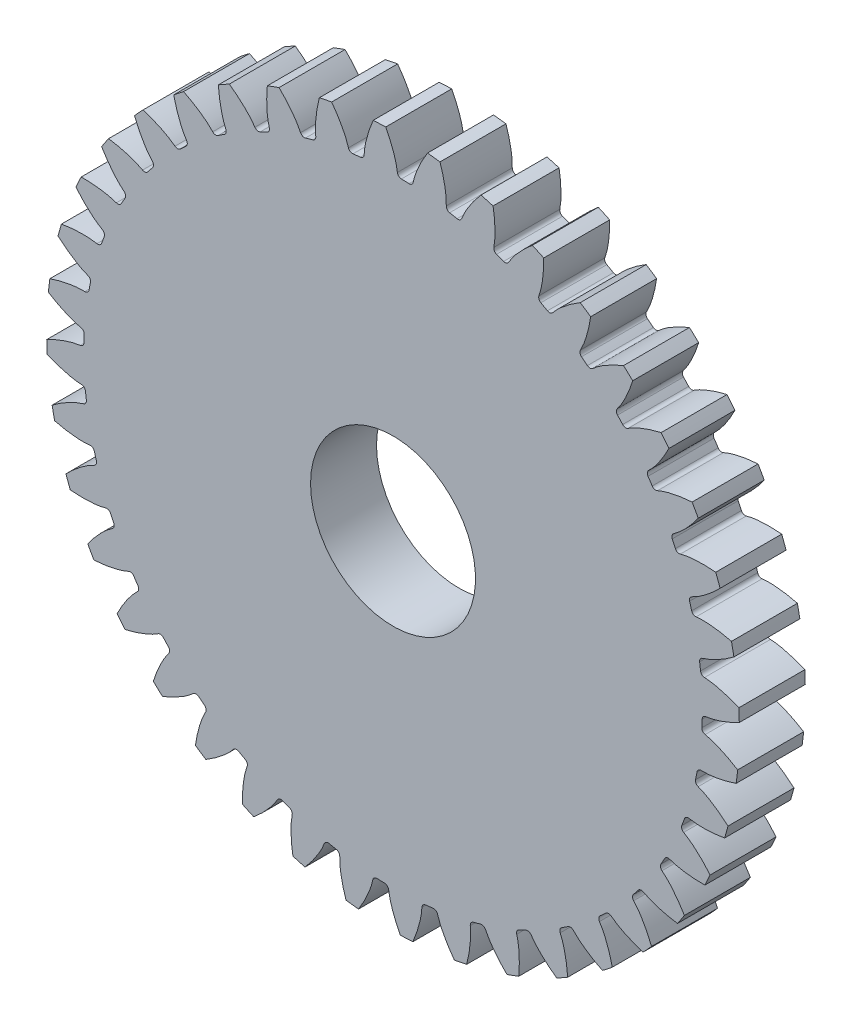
SolidWorks part; units mm, degrees
ref_plane "Face" through (0, 0, 0) normal (0, 0, 1) x (1, 0, 0)
ref_plane "Dessus" through (0, 0, 0) normal (0, 1, 0) x (1, 0, 0)
ref_plane "Droite" through (0, 0, 0) normal (1, 0, 0) x (0, 0, -1)
imported_body "Importée1"
sketch "Esquisse1" plane through (0, 0, 2.1) normal (0, 0, 1) x (1, 0, 0)
  circle A0 centre (0, 0) radius 6.142
  dimension "D1" = 12.284
surface "Surface-primitive" sketch "Esquisse1"
